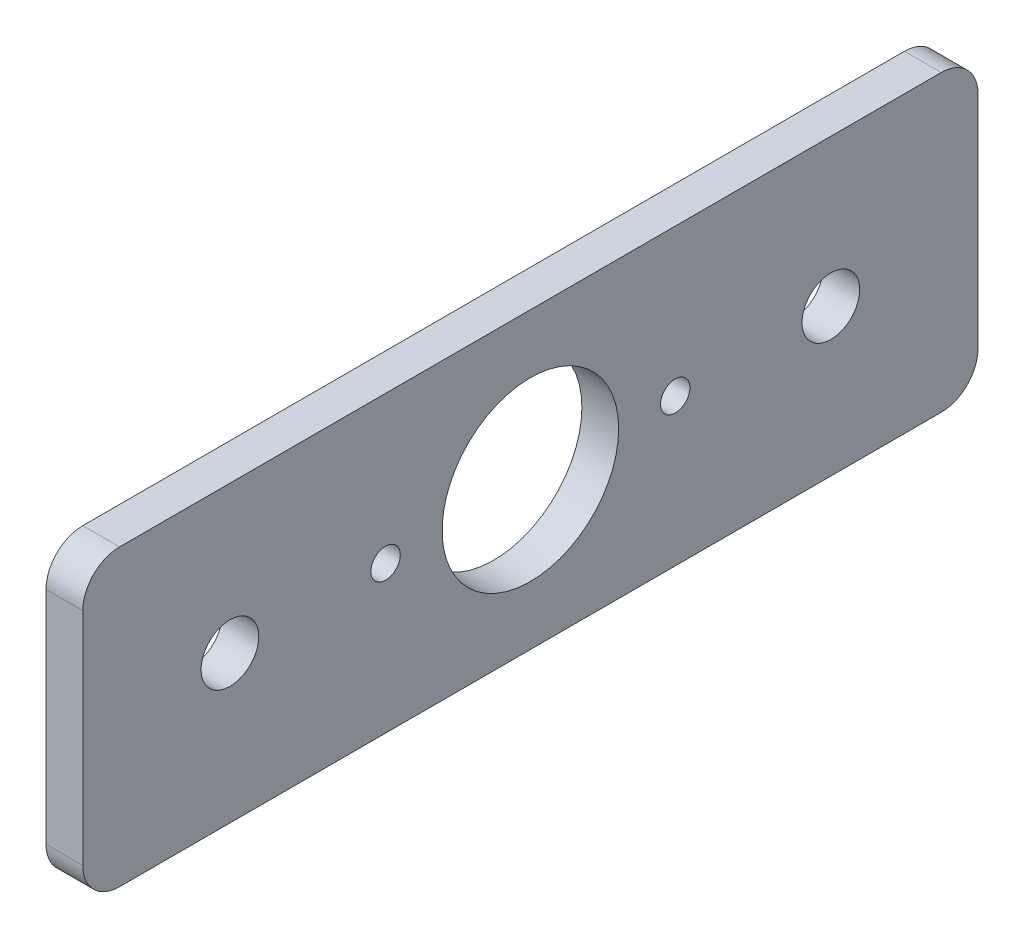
SolidWorks part; units mm, degrees
ref_plane "Front Plane" through (0, 0, 0) normal (0, 0, 1) x (1, 0, 0)
ref_plane "Top Plane" through (0, 0, 0) normal (0, 1, 0) x (1, 0, 0)
ref_plane "Right Plane" through (0, 0, 0) normal (1, 0, 0) x (0, 0, -1)
sketch "Sketch1" plane through (0, 0, 0) normal (1, 0, 0) x (0, 0, -1)
  line L0 (0, 12.7) -> (77.2668, 12.7) construction
  line L1 (0, 0) -> (77.2668, 0)
  line L2 (0, 0) -> (0, 25.4)
  line L3 (0, 25.4) -> (77.2668, 25.4)
  line L4 (77.2668, 0) -> (77.2668, 25.4)
  circle A0 centre (38.6334, 12.7) radius 7.62
  circle A1 centre (51.1334, 12.7) radius 1.27
  circle A2 centre (26.1334, 12.7) radius 1.27
  circle A3 centre (38.6334, 12.7) radius 12.5 construction
  circle A4 centre (64.5668, 12.7) radius 2.4892
  circle A5 centre (12.7, 12.7) radius 2.4892
  dimension "D3" = 15.24
  dimension "D4" = 4.9784
  dimension "D7" = 25
  dimension "D8" = 2.54
  dimension "D1" = 25.4
  dimension "D2" = 77.2668
  dimension "D5" = 12.7
  dimension "D6" = 12.7
extrude "Boss-Extrude1" add sketch "Sketch1" along normal blind 3.175
fillet "Fillet1" radius 3.175 4 edges at (1.5875, 0, -77.2668) (1.5875, 25.4, -77.2668) (1.5875, 0, 0) (1.5875, 25.4, 0)
